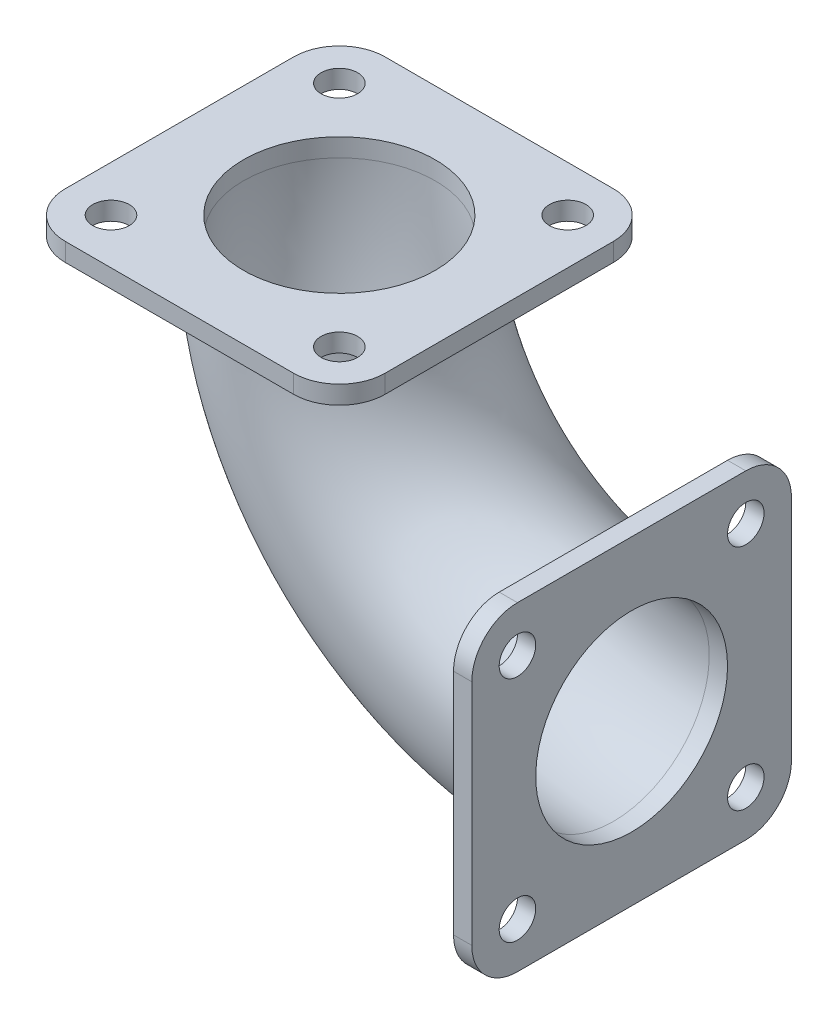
SolidWorks part; units mm, degrees
ref_plane "Front Plane" through (0, 0, 0) normal (0, 0, 1) x (1, 0, 0)
ref_plane "Top Plane" through (0, 0, 0) normal (0, 1, 0) x (1, 0, 0)
ref_plane "Right Plane" through (0, 0, 0) normal (1, 0, 0) x (0, 0, -1)
sketch "Sketch1" plane through (0, 0, 0) normal (1, 0, 0) x (0, 0, -1)
  line L0 (-23.272, 30) -> (26.0015, 30) construction
  circle A0 centre (0, 0) radius 10.5
  circle A1 centre (0, 0) radius 12.5
  dimension "D1" = 21
  dimension "D3" = 30
  dimension "D2" = 2
revolve "Revolve1" add sketch "Sketch1" angle 90 about L0
sketch "Sketch2" plane through (0, 0, 0) normal (1, 0, 0) x (0, 0, -1)
  line L0 (-17.5, 17.5) -> (17.5, -17.5) construction
  line L1 (-12.5, 17.5) -> (12.5, 17.5)
  line L2 (-17.5, 12.5) -> (-17.5, -12.5)
  line L3 (-12.5, -17.5) -> (12.5, -17.5)
  line L4 (17.5, 12.5) -> (17.5, -12.5)
  circle A0 centre (0, 0) radius 12.5 construction
  arc A2 (-12.5, 17.5) -> (-17.5, 12.5) centre (-12.5, 12.5) ccw
  arc A3 (12.5, 17.5) -> (17.5, 12.5) centre (12.5, 12.5) cw
  arc A4 (12.5, -17.5) -> (17.5, -12.5) centre (12.5, -12.5) ccw
  arc A5 (-17.5, -12.5) -> (-12.5, -17.5) centre (-12.5, -12.5) ccw
  circle A6 centre (0, 0) radius 10.5 construction
  circle A7 centre (0, 0) radius 10.5
  dimension "D3" = 5
  dimension "D1" = 5
  dimension "D2" = 5
extrude "Extrude1" add sketch "Sketch2" along normal blind 2
sketch "Sketch4" plane through (-35.373, 30, 10.2823) normal (0, 1, 0) x (-1, 0, 0)
  line L0 (-22.873, 7.2177) -> (12.127, -27.7823) construction
  line L1 (-17.873, 7.2177) -> (7.127, 7.2177)
  line L2 (-22.873, 2.2177) -> (-22.873, -22.7823)
  line L3 (-17.873, -27.7823) -> (7.127, -27.7823)
  line L4 (12.127, 2.2177) -> (12.127, -22.7823)
  circle A1 centre (-5.373, -10.2823) radius 10.5 construction
  arc A2 (-17.873, 7.2177) -> (-22.873, 2.2177) centre (-17.873, 2.2177) ccw
  arc A3 (7.127, 7.2177) -> (12.127, 2.2177) centre (7.127, 2.2177) cw
  arc A4 (7.127, -27.7823) -> (12.127, -22.7823) centre (7.127, -22.7823) ccw
  arc A5 (-22.873, -22.7823) -> (-17.873, -27.7823) centre (-17.873, -22.7823) ccw
  circle A7 centre (-5.373, -10.2823) radius 10.5
  circle A8 centre (-5.373, -10.2823) radius 12.5 construction
  dimension "D3" = 5
  dimension "D1" = 5
  dimension "D2" = 5
extrude "Extrude3" add sketch "Sketch4" along normal blind 2
hole_wizard "Ø4.0 (4) Diameter Hole1" positions "3DSketch1" profile "Sketch5" hole size "Ø4.0" standard "Ansi Metric"
sketch3d "3DSketch1"
  line L0 (-17.5, 32, 12.5) -> (-17.5, 30, 12.5) construction
  line L1 (-17.5, 32, -12.5) -> (-17.5, 30, -12.5) construction
  line L2 (-42.5, 32, -12.5) -> (-42.5, 30, -12.5) construction
  line L3 (-42.5, 32, 12.5) -> (-42.5, 30, 12.5) construction
  line L4 (2, 12.5, -12.5) -> (0, 12.5, -12.5) construction
  line L5 (2, -12.5, -12.5) -> (0, -12.5, -12.5) construction
  line L6 (2, 12.5, 12.5) -> (0, 12.5, 12.5) construction
  line L7 (2, -12.5, 12.5) -> (0, -12.5, 12.5) construction
  point P0 (-17.5, 32, 12.5)
  point P4 (-17.5, 32, -12.5)
  point P8 (-42.5, 32, -12.5)
  point P12 (-42.5, 32, 12.5)
  point P16 (2, 12.5, -12.5)
  point P20 (2, -12.5, -12.5)
  point P24 (2, 12.5, 12.5)
  point P28 (2, -12.5, 12.5)
sketch "Sketch5" plane through (-17.5, 32, 12.5) normal (1, 0, 0) x (0, 0, 1)
  line L0 (0, 0) -> (0, 2)
  line L1 (0, 2) -> (2, 2)
  line L2 (2, 2) -> (2, 0)
  line L5 (2, 0) -> (0, 0)
  line L11 (0, -6.35) -> (0, 107.95) construction
  dimension "Thru Hole Dia." = 4
  dimension "Thru Hole Depth" = 2
